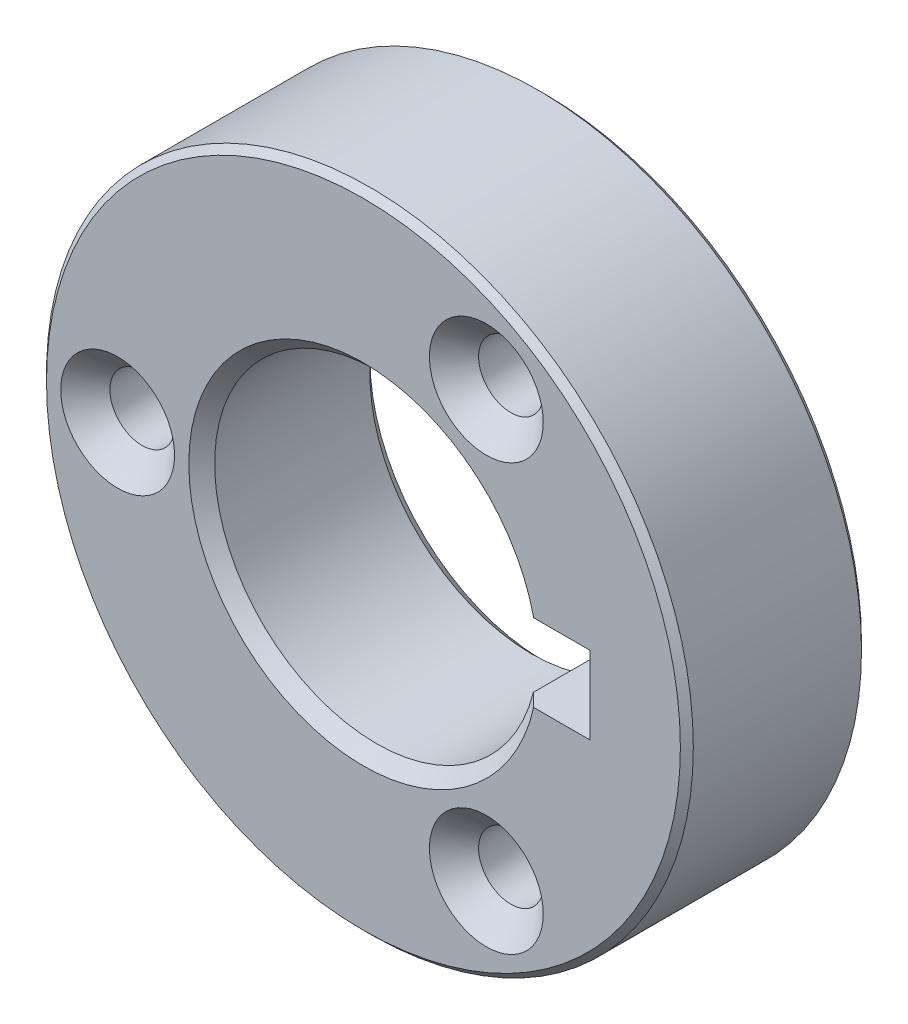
SolidWorks part; units mm, degrees
ref_plane "Plan1" through (0, 0, 0) normal (0, 0, 1) x (1, 0, 0)
ref_plane "Plan2" through (0, 0, 0) normal (0, 1, 0) x (1, 0, 0)
ref_plane "Plan3" through (0, 0, 0) normal (1, 0, 0) x (0, 0, -1)
sketch "Esquisse1" plane through (0, 0, 0) normal (0, 0, 1) x (1, 0, 0)
  line L0 (0, 0) -> (60, 0) construction
  line L1 (12.1347, 3) -> (17.5, 3)
  line L3 (12.1347, -3) -> (17.5, -3)
  line L4 (17.5, 3) -> (17.5, -3)
  circle A0 centre (0, 0) radius 25
  arc A1 (12.1347, 3) -> (12.1347, -3) centre (0, 0) ccw
  dimension "D3" = 25
  dimension "D4" = 50
  dimension "D1" = 6
  dimension "D2" = 17.5
extrude "Base-Extrusion" add sketch "Esquisse1" along normal blind 14
chamfer "Chanfrein1" distance 0.5 angle 45
chamfer "Chanfrein2" distance 1 angle 45
hole_wizard "Perçage1" positions "Esquisse4" profile "Esquisse3" legacy
sketch "Esquisse4" plane through (0, 0, 14) normal (0, 0, 1) x (1, 0, 0)
  line L0 (0, 0) -> (-29, 0) construction
  point P1 (-19, 0)
  point P6 (9.5, 16.4545)
  point P7 (9.5, -16.4545)
  dimension "D1" = 19
sketch "Esquisse3" plane through (-19, 0, 14) normal (1, 0, 0) x (0, -1, 0)
  line L0 (0, 0) -> (0, 7.5022)
  line L1 (0, 7.5022) -> (2.5, 6)
  line L2 (2.5, 6) -> (2.5, 1.9)
  line L3 (2.5, 1.9) -> (4.4, 0)
  line L4 (4.4, 0) -> (0, 0)
  line L5 (0, -14.3089) -> (0, 102.4216) construction
  line L6 (0, 7.5022) -> (-2.5, 6) construction
  line L7 (-2.5, 1.9) -> (-4.4, 0) construction
  dimension "Diamètre" = 5
  dimension "Profondeur" = 6
  dimension "Diamètre fraisé" = 8.8
  dimension "Angle fraisé" = 90
  dimension "Angle" = 118
